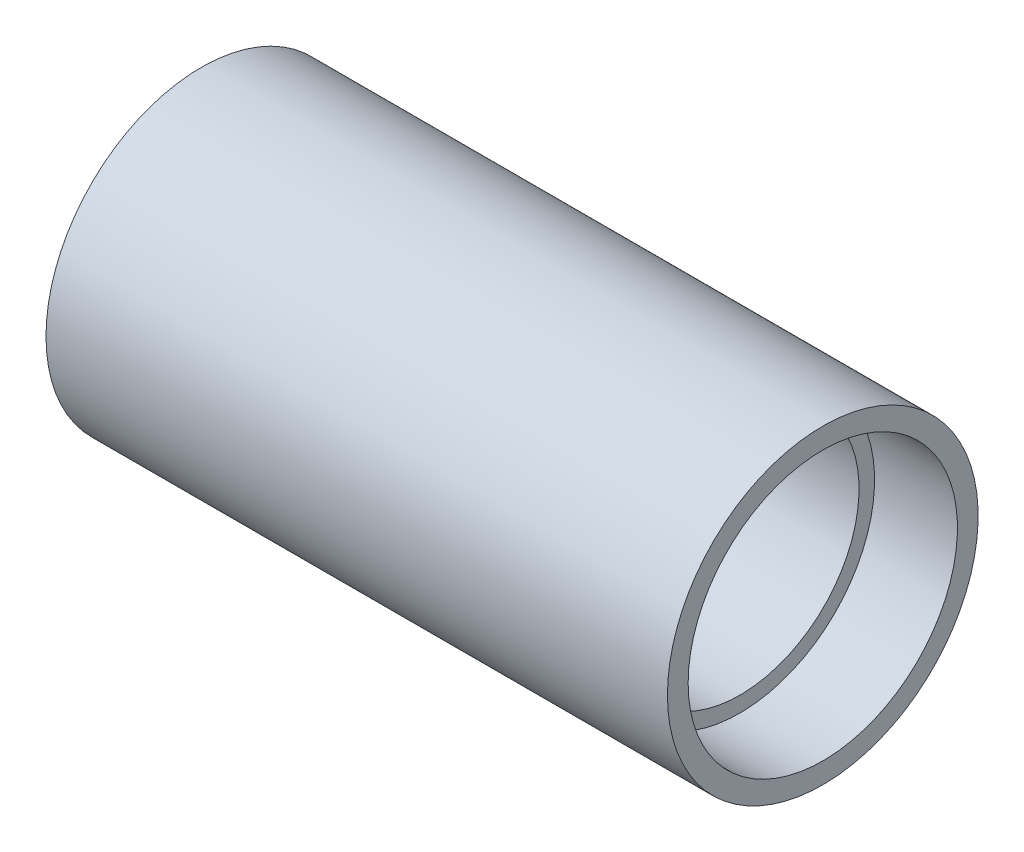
SolidWorks part; units mm, degrees
ref_plane "Face" through (0, 0, 0) normal (0, 0, 1) x (1, 0, 0)
ref_plane "Dessus" through (0, 0, 0) normal (0, 1, 0) x (1, 0, 0)
ref_plane "Droite" through (0, 0, 0) normal (1, 0, 0) x (0, 0, -1)
sketch "Esquisse1" plane through (0, 0, 0) normal (0, 0, 1) x (1, 0, 0)
  line L0 (0, 13) -> (0, 15)
  line L1 (0, 15) -> (60, 15)
  line L2 (60, 15) -> (60, 13)
  line L3 (60, 13) -> (52, 13)
  line L4 (52, 13) -> (52, 11.5)
  line L5 (52, 11.5) -> (8, 11.5)
  line L6 (8, 11.5) -> (8, 13)
  line L7 (8, 13) -> (0, 13)
  line L8 (-4.2172, 0) -> (62.7955, 0) construction
  dimension "D1" = 60
  dimension "D2" = 8
  dimension "D3" = 8
  dimension "D4" = 15
  dimension "D5" = 13
  dimension "D6" = 11.5
  dimension "D7" = 13
revolve "Révolution1" add sketch "Esquisse1" angle 360 about L8
